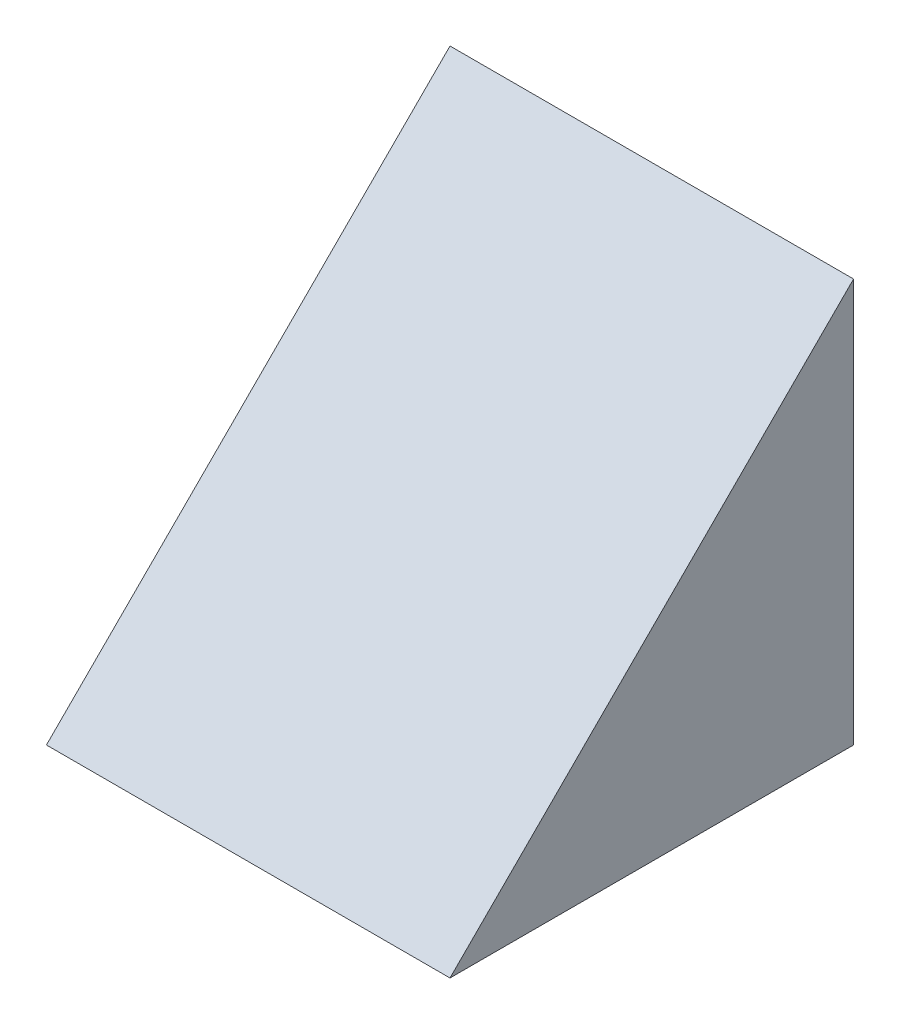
SolidWorks part; units mm, degrees
ref_plane "Front Plane" through (0, 0, 0) normal (0, 0, 1) x (1, 0, 0)
ref_plane "Top Plane" through (0, 0, 0) normal (0, 1, 0) x (1, 0, 0)
ref_plane "Right Plane" through (0, 0, 0) normal (1, 0, 0) x (0, 0, -1)
sketch "Sketch1" plane through (0, 0, 0) normal (0, 1, 0) x (1, 0, 0)
  line L1 (-10, -10) -> (10, -10)
  line L2 (-10, -10) -> (-10, 10)
  line L3 (-10, 10) -> (10, 10)
  line L4 (10, -10) -> (10, 10)
  line L5 (-10, -10) -> (10, 10) construction
  line L6 (-10, 10) -> (10, -10) construction
  point P0 (0, 0)
  dimension "D1" = 20
  dimension "D2" = 20
extrude "Extrude1" add sketch "Sketch1" along normal blind 20
sketch "Sketch2" plane through (0, 0, 10) normal (0, 0, 1) x (1, 0, 0)
  line L0 (0, 20) -> (0, 0) construction
  line L1 (-10, 20) -> (10, 20) construction
  line L3 (-6, 4) -> (6, 4)
  line L4 (-6, 4) -> (-6, 16)
  line L5 (-6, 16) -> (6, 16)
  line L6 (6, 4) -> (6, 16)
  line L7 (-6, 4) -> (6, 16) construction
  line L8 (-6, 16) -> (6, 4) construction
  point P5 (0, 10)
  dimension "D1" = 12
  dimension "D2" = 12
extrude "Extrude2" add sketch "Sketch2" along normal blind 7
chamfer "Chamfer2" distance 20 1 edges at (0, 20, 10)
